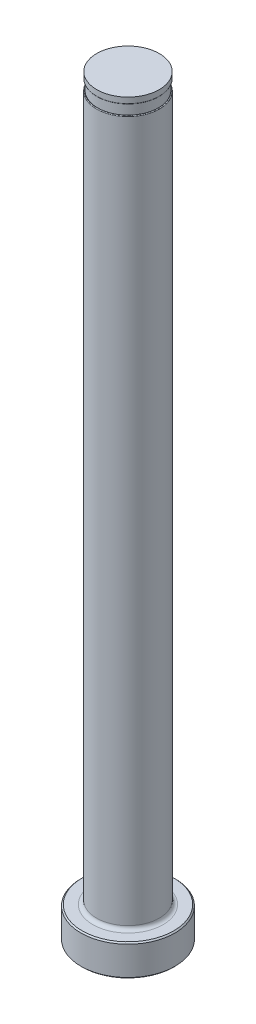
SolidWorks part; units mm, degrees
ref_plane "Front Plane" through (0, 0, 0) normal (0, 0, 1) x (1, 0, 0)
ref_plane "Top Plane" through (0, 0, 0) normal (0, 1, 0) x (1, 0, 0)
ref_plane "Right Plane" through (0, 0, 0) normal (1, 0, 0) x (0, 0, -1)
other "Configuration Table"
sketch "Sketch1" plane through (0, 0, 0) normal (0, 0, 1) x (1, 0, 0)
  line L0 (0, 259.9588) -> (0, -15.1925) construction
  line L1 (0, 0) -> (-9.525, 0)
  line L2 (-9.525, 0) -> (-9.525, 6.35)
  line L3 (-9.525, 6.35) -> (-6.35, 6.35)
  line L4 (-6.35, 6.35) -> (-6.35, 152.4)
  line L5 (-6.35, 152.4) -> (0, 152.4)
  line L6 (0, 152.4) -> (0, 0)
  dimension "L" = 152.4
  dimension "H" = 19.05
  dimension "T" = 6.35
  dimension "D" = 12.7
revolve "Revolve1" add sketch "Sketch1" angle 360 about L0
chamfer "Chamfer1" distance 0.254 angle 45 2 edges at (0, 6.35, 9.525) (0, 0, 9.525)
fillet "Fillet1" radius 0.762 1 edges at (0, 6.35, 6.35)
sketch "Sketch2" plane through (0, 0, 0) normal (0, 0, 1) x (1, 0, 0)
  line L0 (-6.35, 152.4) -> (-6.35, 7.112) construction
  line L1 (-6.35, 151.13) -> (-6.1468, 151.13)
  line L2 (-6.35, 151.13) -> (-6.35, 149.098)
  line L3 (-6.35, 149.098) -> (-6.1468, 149.098)
  line L4 (-6.1468, 151.13) -> (-6.1468, 149.098)
  line L5 (6.35, 152.4) -> (-6.35, 152.4) construction
  line L6 (0, 153.4483) -> (0, 147.3282) construction
  dimension "D1" = 2.032
  dimension "N" = 1.27
  dimension "FD" = 0.2032
  dimension "D3" = 12.2936
revolve "Vent Relief" cut sketch "Sketch2" angle 360 about L6
sketch "Sketch3" plane through (0, 0, 0) normal (0, 0, 1) x (1, 0, 0)
  line L0 (-6.1468, 150.114) -> (-6.1468, 86.614)
  line L1 (-6.1468, 151.13) -> (-6.1468, 149.098) construction
  line L2 (-6.35, 149.098) -> (-6.35, 7.112) construction
  line L3 (-6.35, 85.4964) -> (-6.35, 150.114)
  line L4 (-6.35, 150.114) -> (-6.1468, 150.114)
  arc A0 (-6.1468, 86.614) -> (-6.35, 85.4964) centre (-9.3218, 86.614) cw
  dimension "D1" = 3.175
  dimension "D2" = 63.5
extrude "D-Slot" cut sketch "Sketch3" against normal through all both and the other way through all
sketch "Sketch5" plane through (0, 0, 0) normal (0, 0, 1) x (1, 0, 0)
  line L0 (-6.35, 151.13) -> (6.35, 151.13) construction
  line L1 (-6.35, 152.4) -> (-6.3373, 152.4)
  line L2 (-6.35, 152.4) -> (-6.35, 151.13)
  line L3 (-6.35, 151.13) -> (-6.3373, 151.13)
  line L4 (-6.3373, 152.4) -> (-6.3373, 151.13)
  line L5 (0, 152.6877) -> (0, 150.5771) construction
  dimension "VP" = 0.0127
revolve "Vent Diameter" cut sketch "Sketch5" angle 360 about L5
fillet "Fillet2" radius 0.127 2 edges at (6.35, 149.098, 0) (0, 151.13, 6.3373)
sketch "Pocket Sketch" plane through (0, 0, 0) normal (0, 0, 1) x (1, 0, 0)
  line L0 (-9.9219, 0) -> (-9.9219, 6.3754)
  line L1 (-9.9219, 6.3754) -> (-7.3104, 6.3754)
  line L2 (-6.5484, 7.1374) -> (-6.5484, 22.225)
  line L3 (-6.5484, 22.225) -> (0, 22.225)
  line L4 (0, 22.225) -> (0, 0)
  line L5 (0, 0) -> (-9.9219, 0)
  line L6 (0, 12.6104) -> (0, -2.4989) construction
  line L7 (-9.525, 6.096) -> (-9.525, 0.254) construction
  line L8 (9.271, 6.35) -> (-9.271, 6.35) construction
  line L9 (-6.35, 85.4964) -> (-6.35, 7.112) construction
  line L10 (-7.3104, 6.3754) -> (-6.5484, 7.1374)
  point P3 (-6.5484, 6.3754)
  dimension "D1" = 19.8437
  dimension "D2" = 0.3969
  dimension "D3" = 0.0254
  dimension "D4" = 0.1984
  dimension "D5" = 13.0969
  dimension "D6" = 22.225
